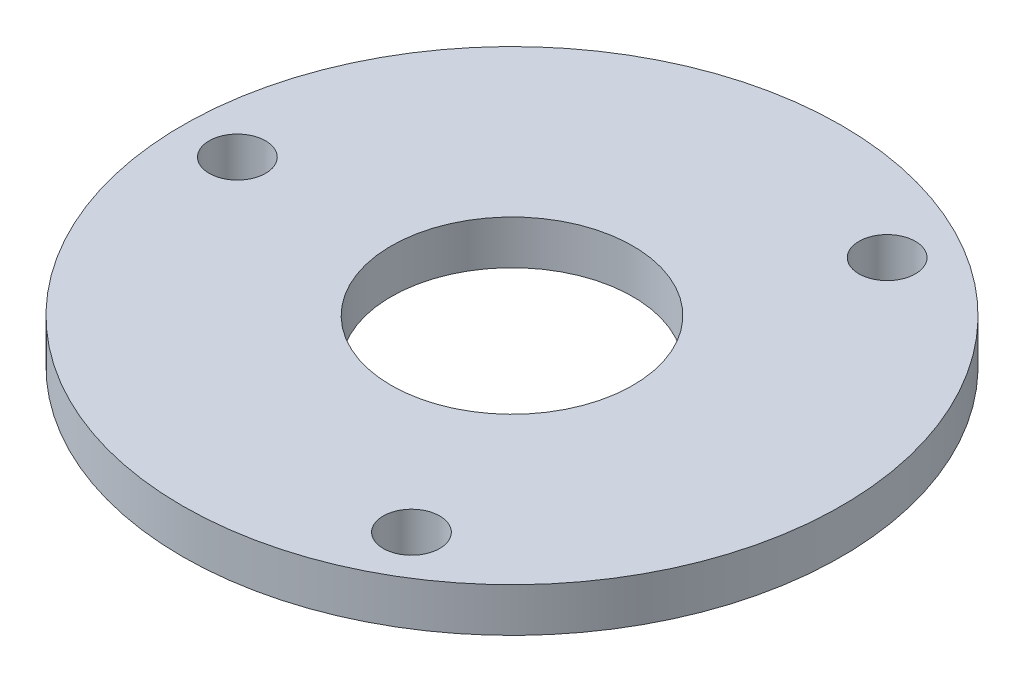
SolidWorks part; units mm, degrees
ref_plane "Front" through (0, 0, 0) normal (0, 0, 1) x (1, 0, 0)
ref_plane "Top" through (0, 0, 0) normal (0, 1, 0) x (1, 0, 0)
ref_plane "Right" through (0, 0, 0) normal (1, 0, 0) x (0, 0, -1)
sketch "Sketch1" plane through (0, 0, 0) normal (0, 1, 0) x (1, 0, 0)
  circle A0 centre (0, 0) radius 19.05
  circle A1 centre (0, 0) radius 6.985
  dimension "D1" = 38.1
  dimension "D2" = 13.97
extrude "Boss-Extrude1" add sketch "Sketch1" along normal blind 2.54
hole_wizard "#4 Clearance Hole1" positions "Sketch2" profile "Sketch3" hole size "#4" standard "ANSI Inch"
sketch "Sketch2" plane through (0, 2.54, 0) normal (0, 1, 0) x (1, 0, 0)
  line L0 (-15.875, 0) -> (0, 0) construction
  point P0 (-15.875, 0)
  dimension "D1" = 15.875
sketch "Sketch3" plane through (-15.875, 2.54, 0) normal (1, 0, 0) x (0, 0, 1)
  line L0 (0, 0) -> (0, 2.54)
  line L1 (0, 2.54) -> (1.6319, 2.54)
  line L2 (1.6319, 2.54) -> (1.6319, 0)
  line L5 (1.6319, 0) -> (0, 0)
  line L11 (0, -6.35) -> (0, 107.95) construction
  dimension "Thru Hole Dia." = 3.2639
  dimension "Thru Hole Depth" = 2.54
pattern_circular "CirPattern1" count 3 over 360 about axis through (0, 0, 0) along (0, 1, 0) of "#4 Clearance Hole1"
